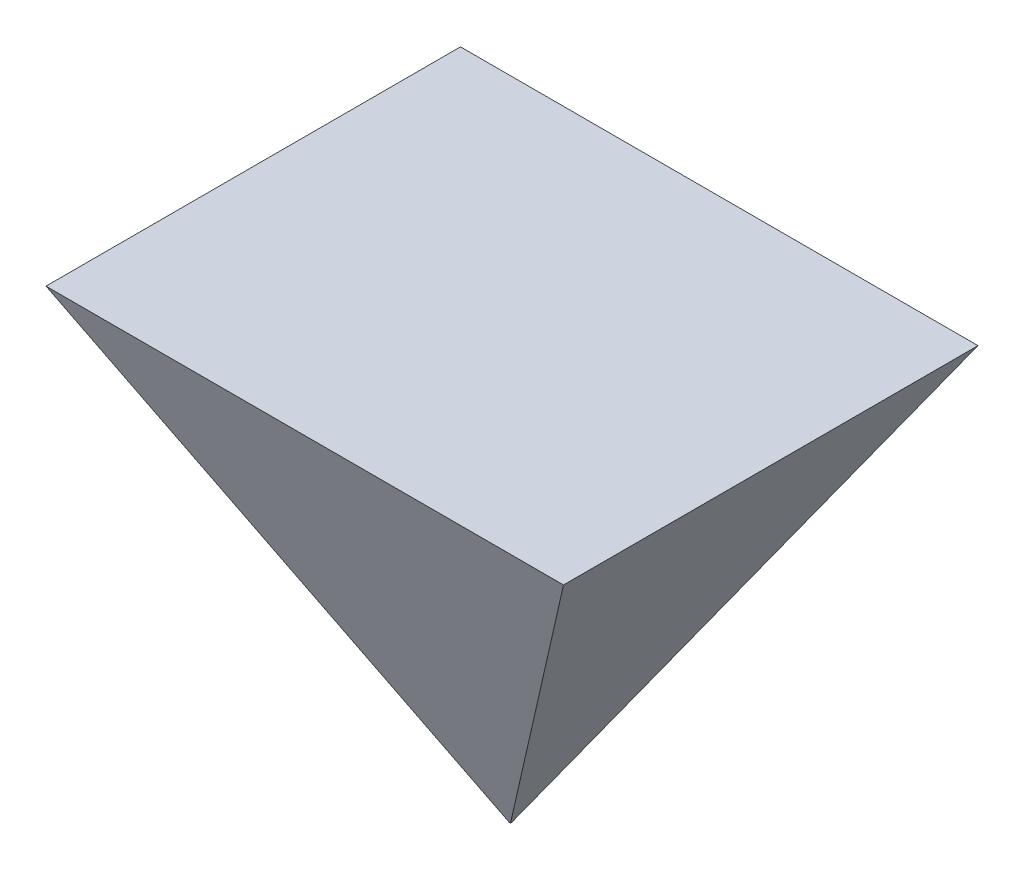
SolidWorks part; units mm, degrees
ref_plane "Front Plane" through (0, 0, 0) normal (0, 0, 1) x (1, 0, 0)
ref_plane "Top Plane" through (0, 0, 0) normal (0, 1, 0) x (1, 0, 0)
ref_plane "Right Plane" through (0, 0, 0) normal (1, 0, 0) x (0, 0, -1)
ref_plane "Plane1" through (0, 2489.2, 0) normal (0, 1, 0) x (-1, 0, 0)
ref_plane "Plane2" through (0, 4978.4, 0) normal (0, 1, 0) x (-1, 0, 0)
sketch "Sketch1" plane through (0, 0, 0) normal (0, 1, 0) x (1, 0, 0)
  line L1 (-6.477, 5.3086) -> (6.477, 5.3086)
  line L2 (-6.477, 5.3086) -> (-6.477, -5.334)
  line L3 (-6.477, -5.334) -> (6.477, -5.334)
  line L4 (6.477, 5.3086) -> (6.477, -5.334)
  dimension "D1" = 10.6426
  dimension "D2" = 12.954
  dimension "D3" = 5.334
  dimension "D4" = 6.477
sketch "Sketch2" plane through (0, 2489.2, 0) normal (0, 1, 0) x (-1, 0, 0)
  line L1 (-1468.12, 1181.1) -> (1452.88, 1181.1)
  line L2 (-1468.12, 1181.1) -> (-1468.12, -1168.4)
  line L3 (-1468.12, -1168.4) -> (1452.88, -1168.4)
  line L4 (1452.88, 1181.1) -> (1452.88, -1168.4)
  dimension "D1" = 2349.5
  dimension "D2" = 2921
  dimension "D3" = 1468.12
  dimension "D4" = 1168.4
sketch "Sketch5" plane through (0, 4978.4, 0) normal (0, 1, 0) x (-1, 0, 0)
  line L1 (-2946.4, 2344.42) -> (2921, 2344.42)
  line L2 (-2946.4, 2344.42) -> (-2946.4, -2354.58)
  line L3 (-2946.4, -2354.58) -> (2921, -2354.58)
  line L4 (2921, 2344.42) -> (2921, -2354.58)
  dimension "D1" = 5867.4
  dimension "D2" = 4699
  dimension "D3" = 2354.58
  dimension "D4" = 2921
loft "Loft7" add profiles "Sketch1", "Sketch5"
